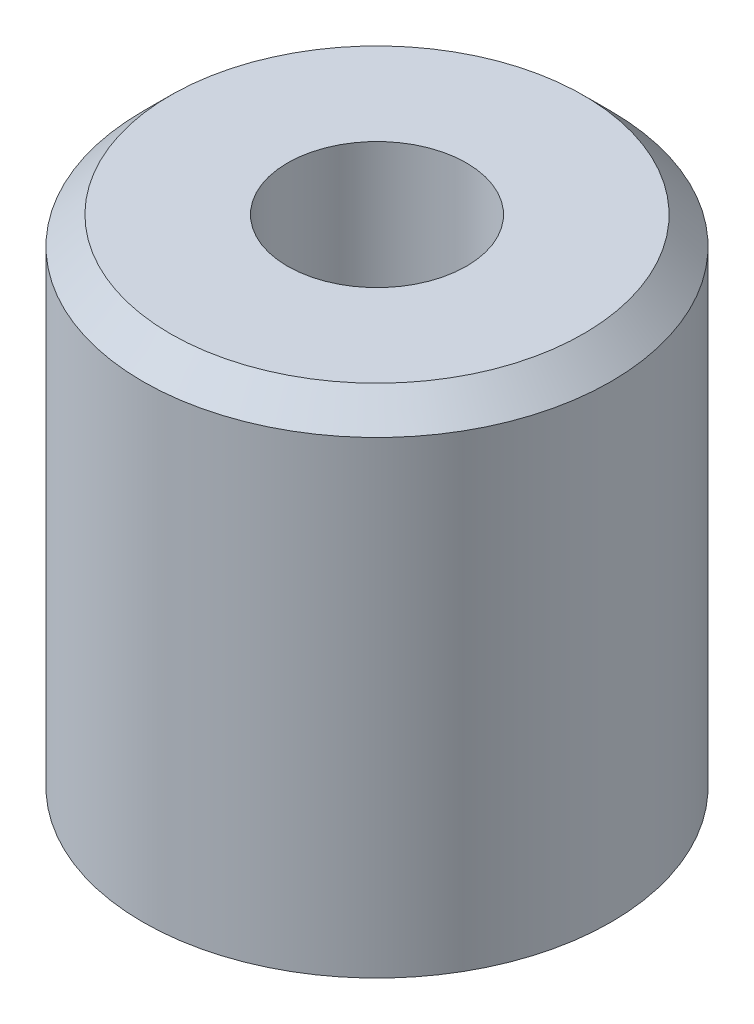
SolidWorks part; units mm, degrees
ref_plane "Přední rovina" through (0, 0, 0) normal (0, 0, 1) x (1, 0, 0)
ref_plane "Horní rovina" through (0, 0, 0) normal (0, 1, 0) x (1, 0, 0)
ref_plane "Pravá rovina" through (0, 0, 0) normal (1, 0, 0) x (0, 0, -1)
sketch "Skica1" plane through (0, 0, 0) normal (0, 1, 0) x (1, 0, 0)
  circle A0 centre (0, 0) radius 8.5
  dimension "D1" = 17
extrude "Přidat vysunutím1" add sketch "Skica1" along normal blind 18
chamfer "Zkosení1" distance 1 angle 45 1 edges at (0, 18, 8.5)
sketch "Skica2" plane through (0, 18, 0) normal (0, 1, 0) x (1, 0, 0)
  circle A0 centre (0, 0) radius 3.25
  dimension "D1" = 6.5
extrude "Odebrat vysunutím1" cut sketch "Skica2" against normal through all
